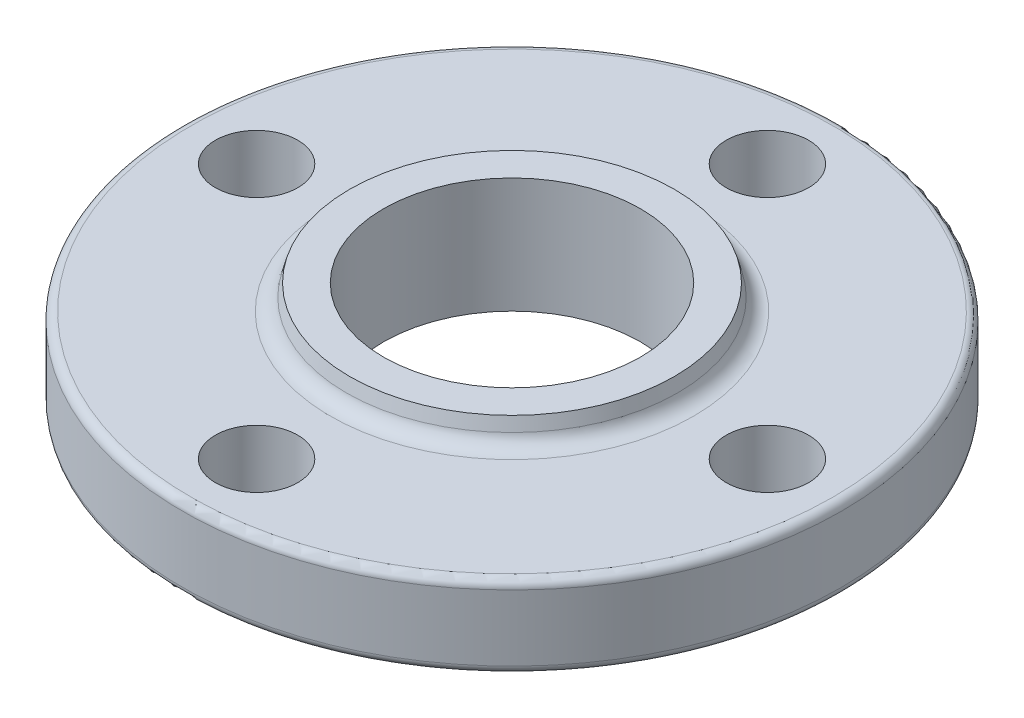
SolidWorks part; units mm, degrees
ref_plane "Front" through (0, 0, 0) normal (0, 0, 1) x (1, 0, 0)
ref_plane "Top" through (0, 0, 0) normal (0, 1, 0) x (1, 0, 0)
ref_plane "Right" through (0, 0, 0) normal (1, 0, 0) x (0, 0, -1)
sketch "Sketch1" plane through (0, 0, 0) normal (0, 0, 1) x (1, 0, 0)
  line L0 (0, 22.225) -> (0, 0) construction
  line L1 (69.85, 0) -> (-69.85, 0) construction
  line L2 (0, -12.2237) -> (0, 12.2237) construction
  line L3 (24.765, 0) -> (36.5125, 0)
  line L4 (36.5125, 0) -> (36.5125, 1.5875)
  line L5 (36.5125, 1.5875) -> (63.5, 1.5875)
  line L6 (63.5, 1.5875) -> (63.5, 17.4625)
  line L7 (63.5, 17.4625) -> (32.5437, 17.4625)
  line L8 (32.5437, 17.4625) -> (31.2676, 22.225)
  line L9 (31.2676, 22.225) -> (24.765, 22.225)
  line L10 (24.765, 22.225) -> (24.765, 0)
  dimension "D1" = 105
  dimension "O" = 127
  dimension "Q" = 17.4625
  dimension "R" = 73.025
  dimension "X" = 65.0875
  dimension "Y" = 22.225
  dimension "W" = 49.53
  dimension "RAISED FACE" = 1.5875
revolve "Revolve1" add sketch "Sketch1" angle 360 about L0
sketch "Sketch2" plane through (0, 1.5875, 0) normal (0, -1, 0) x (1, 0, 0)
  line L0 (12.2237, 0) -> (-12.2237, 0) construction
  circle A0 centre (49.2125, 0) radius 7.9375
  circle A1 centre (0, 0) radius 49.2125 construction
  circle A2 centre (0, 0) radius 63.5 construction
  circle A3 centre (49.2125, 0) radius 6.35 construction
  dimension "BOLT CIRCLE" = 98.425
  dimension "HOLE DIAMETER" = 15.875
  dimension "BOLT DIAMETER" = 12.7
extrude "Cut-Extrude1" cut sketch "Sketch2" against normal through all
pattern_circular "CirPattern1" count 4 over 360 about axis through (0, 0, 0) along (0, 1, 0) of "Cut-Extrude1"
fillet "Fillet1" radius 1.5875 1 edges at (-36.5125, 1.5875, 0)
fillet "Fillet2" radius 3.175 1 edges at (-32.5437, 17.4625, 0)
fillet "Fillet3" radius 1.5875 2 edges at (-63.5, 1.5875, 0) (-63.5, 17.4625, 0)
